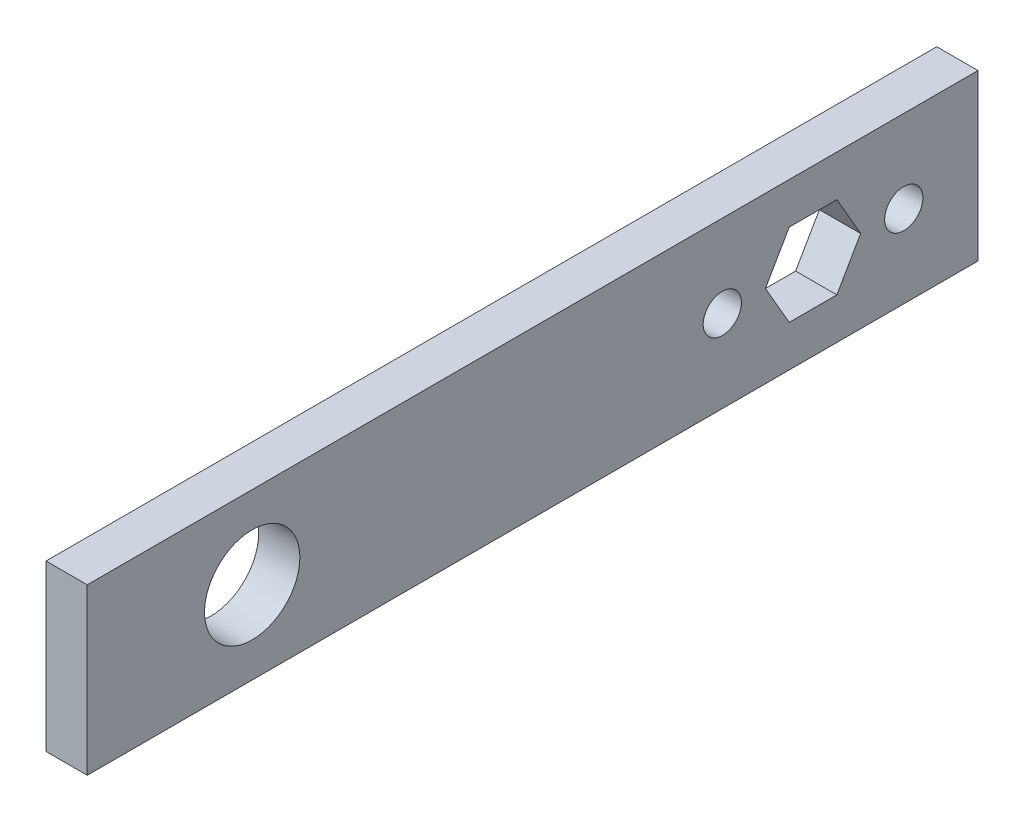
SolidWorks part; units mm, degrees
ref_plane "Front Plane" through (0, 0, 0) normal (0, 0, 1) x (1, 0, 0)
ref_plane "Top Plane" through (0, 0, 0) normal (0, 1, 0) x (1, 0, 0)
ref_plane "Right Plane" through (0, 0, 0) normal (1, 0, 0) x (0, 0, -1)
sketch "Sketch1" plane through (0, 0, 0) normal (1, 0, 0) x (0, 0, -1)
  line L1 (0, 0) -> (68.58, 0)
  line L2 (0, 0) -> (0, 12.7)
  line L3 (0, 12.7) -> (68.58, 12.7)
  line L4 (68.58, 0) -> (68.58, 12.7)
  circle A0 centre (12.7, 6.35) radius 3.6703
  point P8 (0, 6.35)
  dimension "D1" = 7.3406
  dimension "D2" = 12.7
  dimension "D5" = 12.7
  dimension "2.25" = 68.58
extrude "Boss-Extrude1" add sketch "Sketch1" along normal blind 3.175
hole_wizard "#4 Clearance Hole1" positions "Sketch3" profile "Sketch2" hole size "#4" standard "ANSI Inch"
sketch "Sketch3" plane through (3.175, 0, 0) normal (1, 0, 0) x (0, 0, -1)
  circle A0 centre (12.7, 6.35) radius 3.6703 construction
  point P0 (55.88, 6.35)
  point P5 (48.895, 6.35)
  point P6 (62.865, 6.35)
  dimension "D1" = 43.18
  dimension "D2" = 6.985
  dimension "D3" = 6.985
sketch "Sketch2" plane through (3.175, 6.35, -55.88) normal (0, 1, 0) x (0, 0, -1)
  line L0 (0, 0) -> (0, 3.175)
  line L1 (0, 3.175) -> (1.4732, 3.175)
  line L2 (1.4732, 3.175) -> (1.4732, 0)
  line L5 (1.4732, 0) -> (0, 0)
  line L11 (0, -6.35) -> (0, 107.95) construction
  dimension "Thru Hole Dia." = 2.9464
  dimension "Thru Hole Depth" = 3.175
sketch "Sketch4" plane through (3.175, 0, 0) normal (1, 0, 0) x (0, 0, -1)
  line L1 (59.5462, 6.35) -> (57.7131, 9.525)
  line L2 (57.7131, 9.525) -> (54.0469, 9.525)
  line L3 (54.0469, 9.525) -> (52.2138, 6.35)
  line L4 (52.2138, 6.35) -> (54.0469, 3.175)
  line L5 (54.0469, 3.175) -> (57.7131, 3.175)
  line L6 (57.7131, 3.175) -> (59.5462, 6.35)
  circle A0 centre (55.88, 6.35) radius 3.175 construction
  dimension "D1" = 6.35
  dimension "D2" = 7.3323
extrude "Cut-Extrude1" cut sketch "Sketch4" against normal through all
